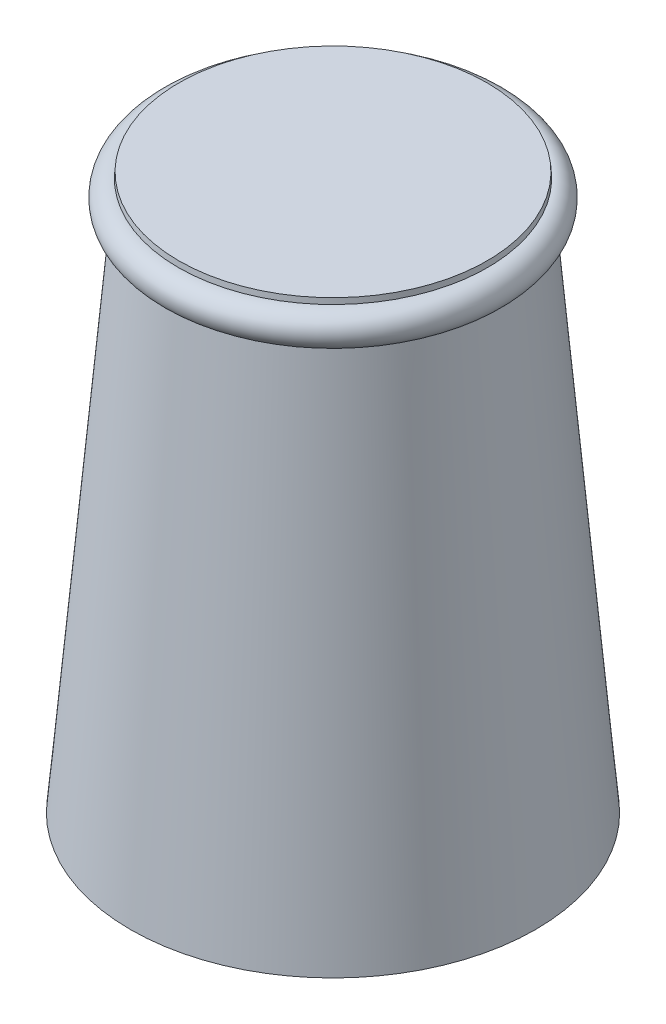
SolidWorks part; units mm, degrees
ref_plane "Ebene vorne" through (0, 0, 0) normal (0, 0, 1) x (1, 0, 0)
ref_plane "Ebene oben" through (0, 0, 0) normal (0, 1, 0) x (1, 0, 0)
ref_plane "Ebene rechts" through (0, 0, 0) normal (1, 0, 0) x (0, 0, -1)
sketch "Skizze1" plane through (0, 0, 0) normal (0, 1, 0) x (1, 0, 0)
  circle A0 centre (0, 0) radius 18.265
extrude "Linear austragen1" add sketch "Skizze1" along normal blind 50 draft 5
sketch "Skizze2" plane through (0, 0, 0) normal (0, 0, 1) x (1, 0, 0)
  line L0 (18.265, 0) -> (13.8906, 50) construction
  line L1 (14.1963, 46.5057) -> (13.9348, 49.4943)
  line L2 (13.8906, 50) -> (-13.8906, 50) construction
  arc A0 (14.1963, 46.5057) -> (13.9348, 49.4943) centre (14.0656, 48) ccw
  dimension "D2" = 3
  dimension "D1" = 2
revolve "Rotation2" add sketch "Skizze2" angle 360 about axis through (0, 0, 0) along (0, -1, 0)
